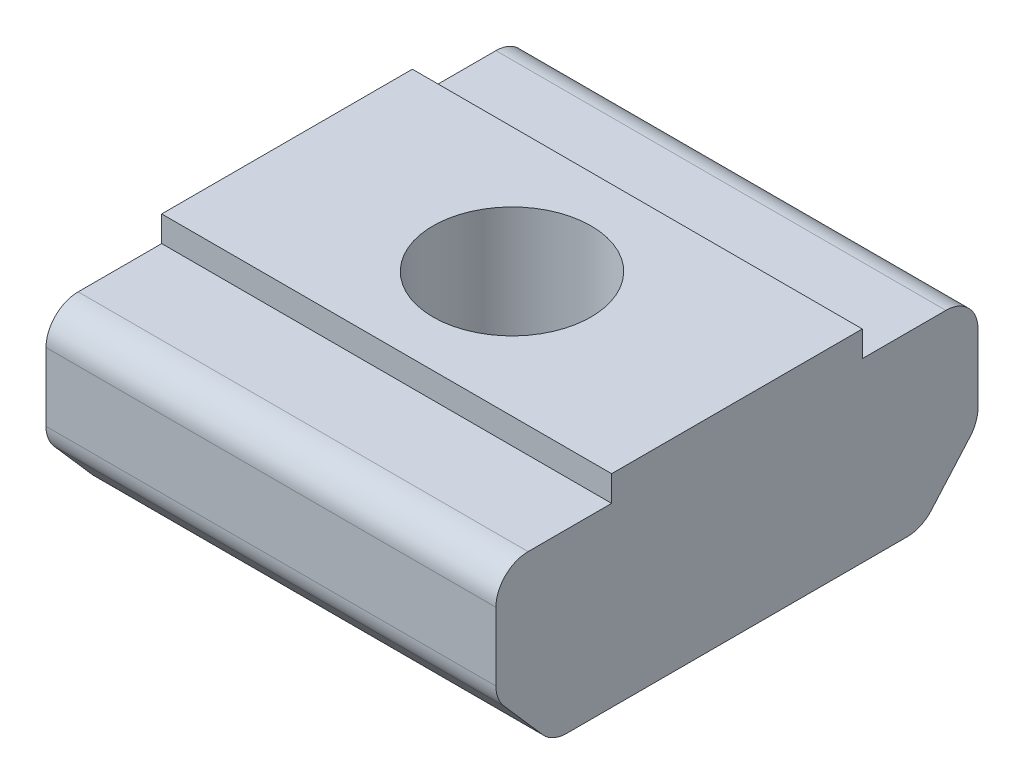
SolidWorks part; units mm, degrees
ref_plane "Front Plane" through (0, 0, 0) normal (0, 0, 1) x (1, 0, 0)
ref_plane "Top Plane" through (0, 0, 0) normal (0, 1, 0) x (1, 0, 0)
ref_plane "Right Plane" through (0, 0, 0) normal (1, 0, 0) x (0, 0, -1)
ref_plane "Plane1" through (-7, 0, 0) normal (1, 0, 0) x (0, 0, -1)
ref_plane "Plane2" through (-4.2, 0, 0) normal (1, 0, 0) x (0, 0, -1)
sketch "Axis_Line_X" plane through (0, 0, 0) normal (0, 1, 0) x (1, 0, 0)
  line L0 (0, 0) -> (50, 0)
  dimension "FIX_3" = 50
sketch "Axis_Line_Z" plane through (0, 0, 0) normal (0, 1, 0) x (1, 0, 0)
  line L0 (0, 0) -> (0, -50)
  dimension "FIX_4" = 50
sketch "Sketch1" plane through (-7, 0, 0) normal (1, 0, 0) x (0, 0, -1)
  line L0 (5.75, -6.3) -> (-5.75, -6.3)
  line L1 (-7.5, -0.8) -> (-7.5, -4.3)
  line L2 (-7.5, -0.8) -> (-3.9, -0.8)
  line L3 (-3.9, -0.8) -> (-3.9, 0)
  line L4 (-3.9, 0) -> (3.9, 0)
  line L5 (3.9, 0) -> (3.9, -0.8)
  line L6 (3.9, -0.8) -> (7.5, -0.8)
  line L7 (7.5, -0.8) -> (7.5, -4.3)
  line L8 (7.5, -4.3) -> (5.75, -6.3)
  line L9 (0, 0) -> (0, -6.3) construction
  line L10 (-7.5, -4.3) -> (-5.75, -6.3)
  point P15 (-7.5, -0.8)
  point P18 (-7.5, -4.3)
  point P21 (-5.75, -6.3)
  point P24 (5.75, -6.3)
  point P27 (7.5, -4.3)
  point P30 (7.5, -0.8)
  dimension "FIX_8" = 5.5
  dimension "FIX_6" = 7.8
  dimension "FIX_7" = 6.3
  dimension "FIX_9" = 3.5
  dimension "FIX_5" = 15
  dimension "FIX_10" = 11.5
extrude "Boss-Extrude1" add sketch "Sketch1" along normal blind 14
fillet "Fillet1" radius 1 6 edges at (0, -0.8, 7.5) (0, -4.3, 7.5) (0, -6.3, 5.75) (0, -6.3, -5.75) (0, -4.3, -7.5) (0, -0.8, -7.5)
hole_wizard "Tapped Hole1" positions "Sketch3" profile "Sketch2" tap size "M6x1.0" standard "JIS"
sketch "Sketch3" plane through (0, 0, 0) normal (0, 1, 0) x (1, 0, 0)
  point P0 (0, 0)
sketch "Sketch2" plane through (0, 0, 0) normal (1, 0, 0) x (0, 0, 1)
  line L0 (0, 0) -> (0, 6.3)
  line L1 (0, 6.3) -> (2.4585, 6.3)
  line L2 (2.4585, 6.3) -> (2.4585, 0)
  line L5 (2.4585, 0) -> (0, 0)
  line L11 (0, 0) -> (0, 6.3) construction
  dimension "Thru Tap Drill Dia." = 4.917
  dimension "Thru Tap Drill Depth" = 6.3
sketch "Sketch4" [suppressed] plane through (-4.2, 0, 0) normal (1, 0, 0) x (0, 0, -1)
  line L0 (6.1, -0.75) -> (6.1, -0.8)
  line L1 (6.1, -0.8) -> (6.15, -0.8)
  line L2 (6.1, -0.75) -> (6.1, -0.8) construction
  arc A0 (6.15, -0.8) -> (6.1, -0.75) centre (6.1, -0.8) ccw
  dimension "FIX_14" = 0.1
  dimension "FIX_13" = 0.8
  dimension "FIX_12" = 6.1
revolve "Revolve1" [suppressed] add sketch "Sketch4" angle 360 about L2
pattern_linear "LPattern1" [suppressed]
